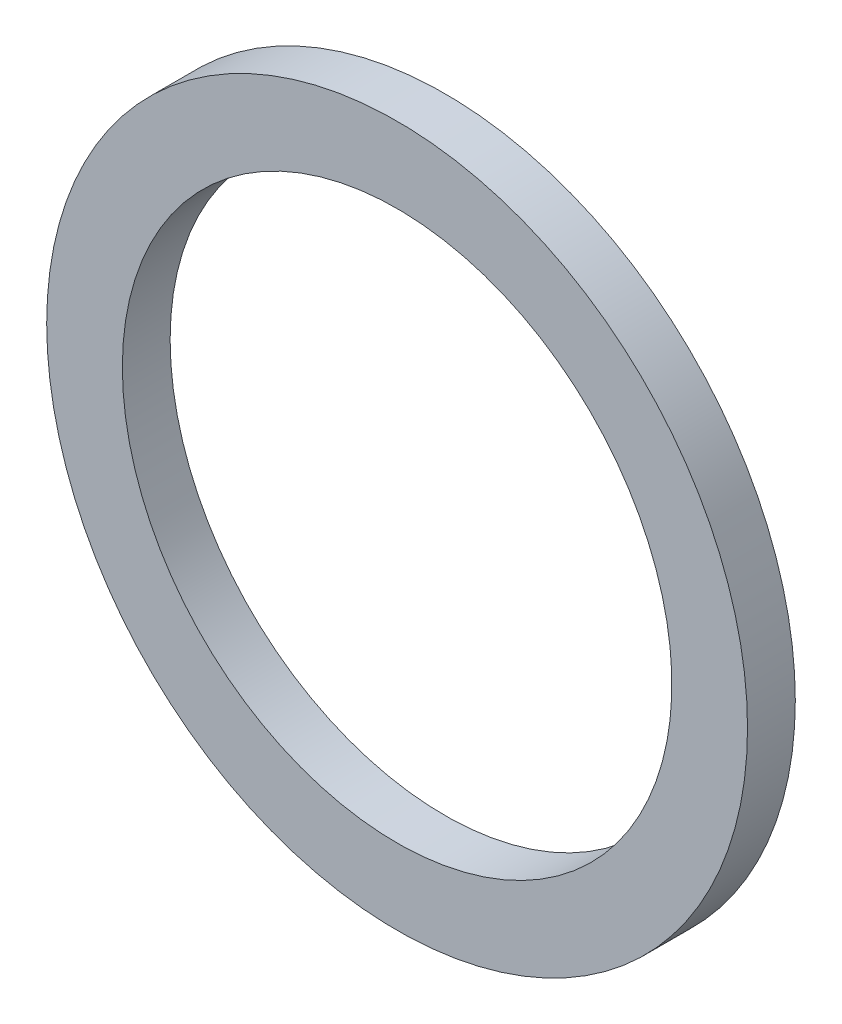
SolidWorks part; units mm, degrees
ref_plane "Front" through (0, 0, 0) normal (0, 0, 1) x (1, 0, 0)
ref_plane "Top" through (0, 0, 0) normal (0, 1, 0) x (1, 0, 0)
ref_plane "Right" through (0, 0, 0) normal (1, 0, 0) x (0, 0, -1)
sketch "Sketch1" plane through (0, 0, 0) normal (0, 0, 1) x (1, 0, 0)
  circle A0 centre (0, 0) radius 8.625
  circle A1 centre (0, 0) radius 11
  dimension "D1" = 17.25
  dimension "D2" = 2.375
extrude "Base-Extrude" add sketch "Sketch1" along normal blind 1.5
